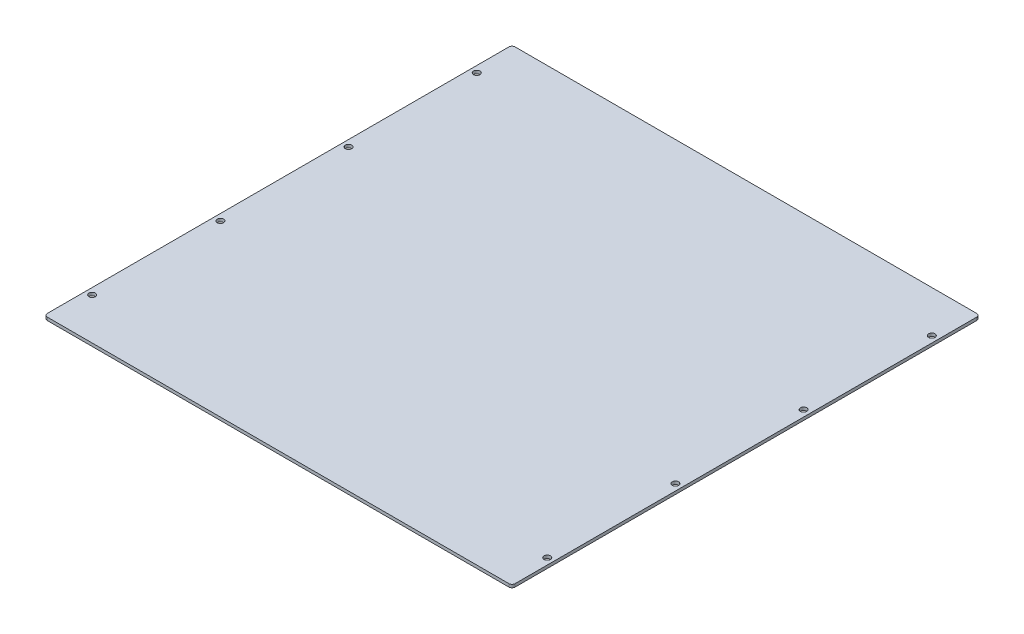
SolidWorks part; units mm, degrees
ref_plane "Front Plane" through (0, 0, 0) normal (0, 0, 1) x (1, 0, 0)
ref_plane "Top Plane" through (0, 0, 0) normal (0, 1, 0) x (1, 0, 0)
ref_plane "Right Plane" through (0, 0, 0) normal (1, 0, 0) x (0, 0, -1)
sketch "Sketch1" plane through (0, 0, 0) normal (0, 1, 0) x (1, 0, 0)
  line L1 (-231.775, 231.775) -> (231.775, 231.775)
  line L2 (-231.775, 231.775) -> (-231.775, -231.775)
  line L3 (-231.775, -231.775) -> (231.775, -231.775)
  line L4 (231.775, 231.775) -> (231.775, -231.775)
  line L5 (-231.775, 231.775) -> (231.775, -231.775) construction
  line L6 (-231.775, -231.775) -> (231.775, 231.775) construction
  point P0 (0, 0)
  dimension "D1" = 463.55
  dimension "D2" = 463.55
extrude "Boss-Extrude1" add sketch "Sketch1" along normal blind 2.9972
fillet "Fillet1" radius 3.175 4 edges at (-231.775, 1.4986, -231.775) (231.775, 1.4986, -231.775) (231.775, 1.4986, 231.775) (-231.775, 1.4986, 231.775)
hole_wizard "1/4 (0.25) Diameter Hole1" positions "Sketch5" profile "Sketch4" hole size "1/4" standard "ANSI Inch"
sketch "Sketch5" plane through (0, 2.9972, 0) normal (0, 1, 0) x (1, 0, 0)
  line L3 (-231.775, 228.6) -> (-231.775, -228.6) construction
  line L4 (231.775, -228.6) -> (231.775, 228.6) construction
  point P46 (-225.425, 190.5)
  point P57 (225.425, 190.5)
  point P58 (225.425, 63.5)
  point P59 (225.425, -63.5)
  point P60 (225.425, -190.5)
  point P61 (-225.425, 63.5)
  point P62 (-225.425, -63.5)
  point P63 (-225.425, -190.5)
sketch "Sketch4" plane through (-225.425, 2.9972, -190.5) normal (1, 0, 0) x (0, 0, 1)
  line L0 (0, 0) -> (0, 2.9972)
  line L1 (0, 2.9972) -> (3.175, 2.9972)
  line L2 (3.175, 2.9972) -> (3.175, 0)
  line L5 (3.175, 0) -> (0, 0)
  line L11 (0, -6.35) -> (0, 107.95) construction
  dimension "Thru Hole Dia." = 6.35
  dimension "Thru Hole Depth" = 2.9972
equation "\"D1@Sketch5\"=\"D5@Sketch5\"/2"
